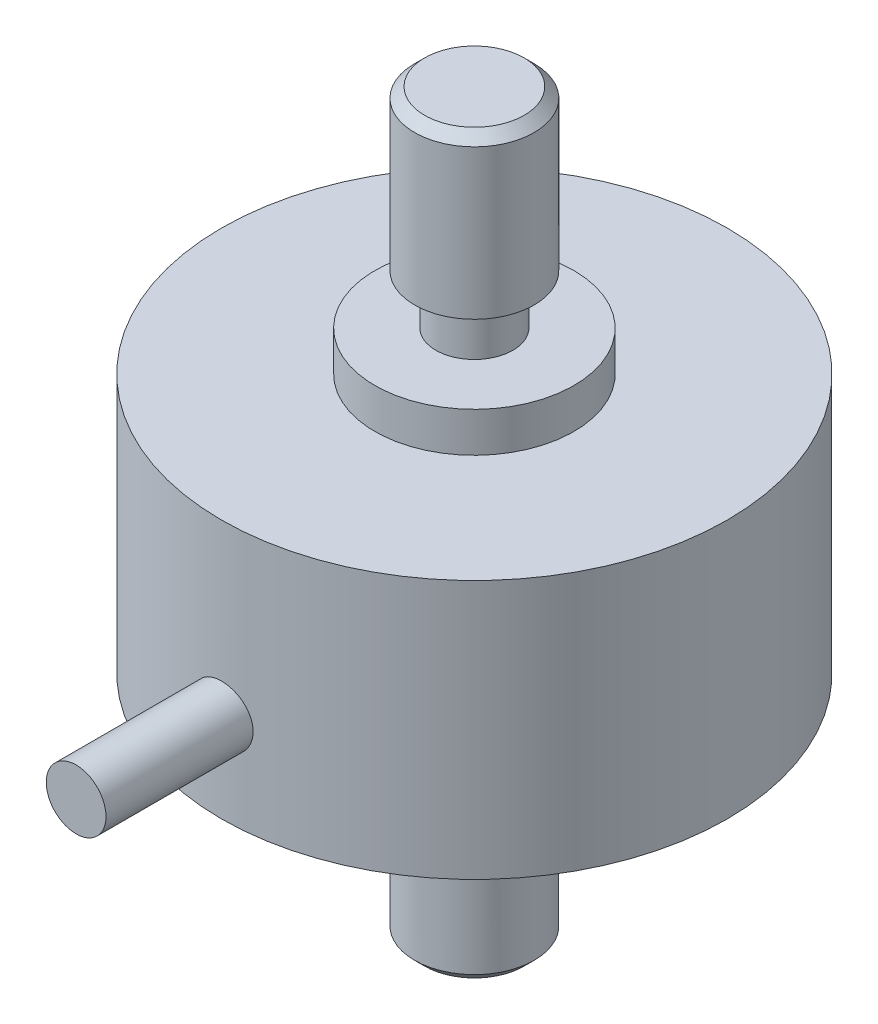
SolidWorks part; units mm, degrees
ref_plane "Front Plane" through (0, 0, 0) normal (0, 0, 1) x (1, 0, 0)
ref_plane "Top Plane" through (0, 0, 0) normal (0, 1, 0) x (1, 0, 0)
ref_plane "Right Plane" through (0, 0, 0) normal (1, 0, 0) x (0, 0, -1)
sketch "Sketch1" plane through (0, 0, 0) normal (0, 0, 1) x (1, 0, 0)
  line L0 (0, 0) -> (0, 37) construction
  line L1 (0, 37) -> (-3, 37)
  line L2 (-3, 37) -> (-3, 29)
  line L3 (-3, 29) -> (-1.9364, 29)
  line L4 (-1.9364, 29) -> (-1.9364, 26.5)
  line L5 (-1.9364, 26.5) -> (-5, 26.5)
  line L6 (-5, 26.5) -> (-5, 24.5)
  line L7 (-5, 24.5) -> (-12.7, 24.5)
  line L8 (-12.7, 24.5) -> (-12.7, 11.5)
  line L9 (-12.7, 11.5) -> (-3.3, 11.5)
  line L10 (-3.3, 11.5) -> (-3.3, 10.5)
  line L11 (-3.3, 10.5) -> (-2.3093, 10.5)
  line L12 (-2.3093, 10.5) -> (-2.3093, 8)
  line L13 (-2.3093, 8) -> (-3, 8)
  line L14 (-3, 8) -> (-3, 0)
  line L15 (-3, 0) -> (0, 0)
  line L16 (0, 37) -> (0, 0)
  dimension "D1" = 37
  dimension "D2" = 13
  dimension "D3" = 5
  dimension "D4" = 12.7
  dimension "D5" = 12.5
  dimension "D6" = 10.5
  dimension "D7" = 8
  dimension "D8" = 8
  dimension "D9" = 10.5
  dimension "D10" = 3.3
  dimension "D11" = 3
  dimension "D12" = 3
revolve "Revolve1" add sketch "Sketch1" angle 360 about L0
ref_plane "Plane1" through (0, 0, 0) normal (0, 0, 1) x (1, 0, 0)
sketch "Sketch2" plane through (0, 0, 0) normal (0, 0, 1) x (1, 0, 0)
  line L0 (0, 37) -> (0, 0) construction
  line L1 (-12.7, 11.5) -> (12.7, 11.5) construction
  circle A0 centre (0, 16) radius 1.5
  dimension "D2" = 3
  dimension "D1" = 4.5
extrude "Boss-Extrude1" add sketch "Sketch2" along normal blind 20
chamfer "Chamfer1" distance 0.5 angle 45 2 edges at (0, 0, -3) (0, 37, -3)
